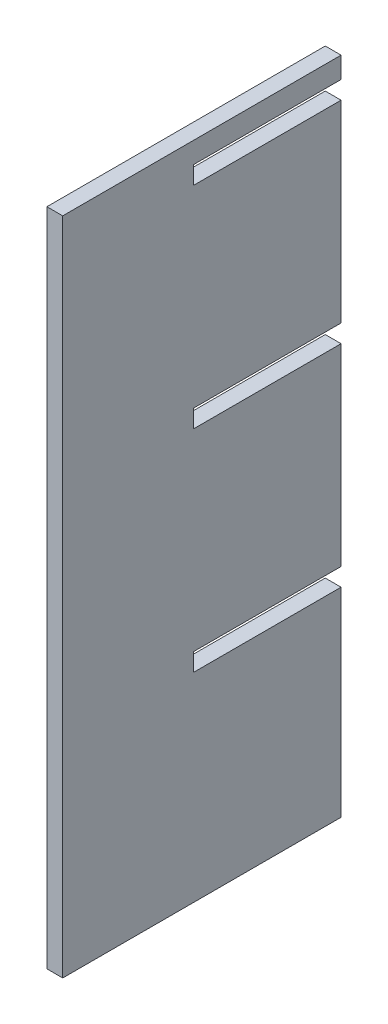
SolidWorks part; units mm, degrees
ref_plane "Alzado" through (0, 0, 0) normal (0, 0, 1) x (1, 0, 0)
ref_plane "Planta" through (0, 0, 0) normal (0, 1, 0) x (1, 0, 0)
ref_plane "Vista lateral" through (0, 0, 0) normal (1, 0, 0) x (0, 0, -1)
sketch "Croquis16" plane through (0, 0, 0) normal (0, 0, 1) x (1, 0, 0)
  line L0 (-18.25, -39.75) -> (-16.75, -39.75)
  line L1 (-18.5, -40) -> (-16.5, -40) construction
  line L2 (-18.5, -40) -> (-18.5, 40) construction
  line L3 (-18.5, 40) -> (-16.5, 40) construction
  line L4 (-16.5, -40) -> (-16.5, 40) construction
  line L5 (-16.75, -39.75) -> (-16.75, 39.75)
  line L6 (-18.25, 39.75) -> (-16.75, 39.75)
  line L7 (-18.25, -39.75) -> (-18.25, 39.75)
  dimension "D1" = 0.25
extrude "Saliente-Extruir9" add sketch "Croquis16" along normal blind 26.4
sketch "Croquis20" plane through (-16.75, 0, 0) normal (1, 0, 0) x (0, 0, -1)
  line L1 (0, -20.85) -> (-14, -20.85)
  line L2 (0, -20.85) -> (0, -19.15)
  line L3 (0, -19.15) -> (-14, -19.15)
  line L4 (-14, -20.85) -> (-14, -19.15)
  line L10 (0, -0.85) -> (-14, -0.85)
  line L11 (0, -0.85) -> (0, 0.85)
  line L12 (0, 0.85) -> (-14, 0.85)
  line L13 (-14, -0.85) -> (-14, 0.85)
  line L14 (0, 19.15) -> (-14, 19.15)
  line L15 (0, 19.15) -> (0, 20.85)
  line L16 (0, 20.85) -> (-14, 20.85)
  line L17 (-14, 19.15) -> (-14, 20.85)
  line L22 (0, -39.75) -> (0, 39.75) construction
  dimension "D1" = 1.7
  dimension "D2" = 14
  dimension "D4" = 1.7
  dimension "D5" = 1.7
  dimension "D6" = 14
  dimension "D7" = 14
extrude "Cortar-Extruir2" cut sketch "Croquis20" against normal up to surface (1.5 mm away)
sketch "Croquis21" plane through (-16.75, 0, 0) normal (1, 0, 0) x (0, 0, -1)
  line L0 (0, 20.85) -> (0, 39.75) construction
  line L1 (0, 22.85) -> (-26.4, 22.85)
  line L2 (0, 22.85) -> (0, 39.75)
  line L3 (0, 39.75) -> (-26.4, 39.75)
  line L4 (-26.4, 22.85) -> (-26.4, 39.75)
  line L6 (0, 20.85) -> (-14, 20.85) construction
  dimension "D1" = 2
extrude "Cortar-Extruir3" cut sketch "Croquis21" against normal up to surface (1.5 mm away)
